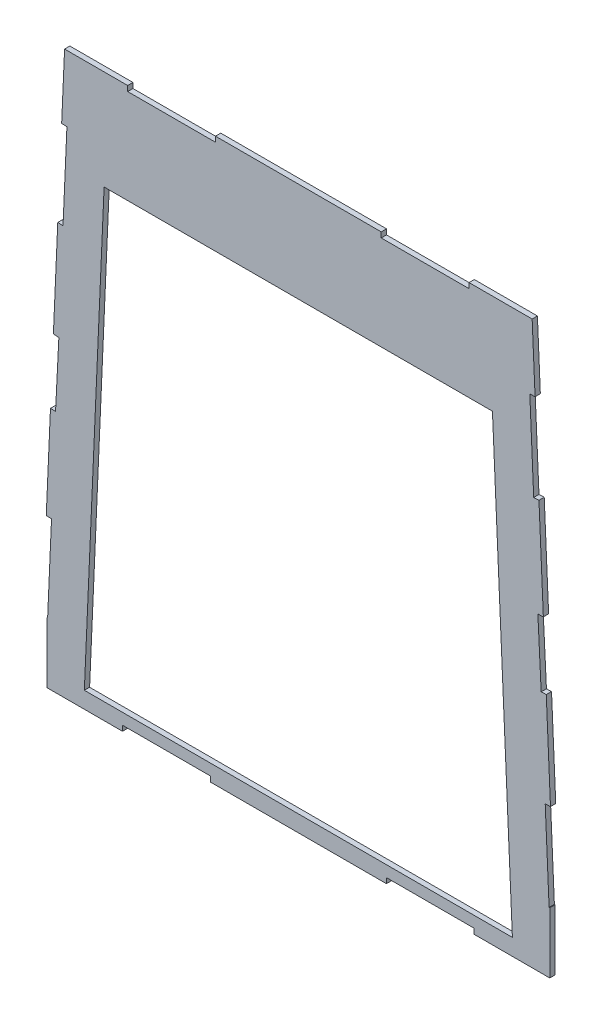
SolidWorks part; units mm, degrees
ref_plane "Front Plane" through (0, 0, 0) normal (0, 0, 1) x (1, 0, 0)
ref_plane "Top Plane" through (0, 0, 0) normal (0, 1, 0) x (1, 0, 0)
ref_plane "Right Plane" through (0, 0, 0) normal (1, 0, 0) x (0, 0, -1)
sketch "Sketch1" plane through (0, 0, 0) normal (0, 0, 1) x (1, 0, 0)
  line L0 (64.2461, -53.3168) -> (58.4748, 75.6208)
  line L1 (58.4748, 75.6208) -> (-53.8589, 75.6208)
  line L2 (-53.8589, 75.6208) -> (-59.5769, -53.3168)
  line L3 (70.4092, 59.9698) -> (69.2839, 85.3449)
  line L4 (69.9616, 104.463) -> (51.7102, 104.463)
  line L5 (-65.2924, 104.463) -> (-66.1372, 85.4124)
  line L6 (77.1698, -58.0793) -> (53.2038, -58.0793)
  line L7 (73.1993, 31.4539) -> (71.6181, 31.3847)
  line L8 (53.2038, -58.0793) -> (53.2038, -56.5553)
  line L9 (64.2461, -53.3168) -> (-59.5769, -53.3168)
  line L10 (27.8038, -58.0793) -> (27.8038, -56.5553)
  line L11 (-48.5345, -56.5553) -> (-23.1345, -56.5553)
  line L12 (53.2038, -56.5553) -> (27.8038, -56.5553)
  line L13 (27.8038, -58.0793) -> (-23.1345, -58.0793)
  line L14 (-23.1345, -58.0793) -> (-23.1345, -56.5553)
  line L15 (-48.5345, -58.0793) -> (-48.5345, -56.5553)
  line L16 (-48.5345, -58.0793) -> (-72.5005, -58.0793)
  line L17 (-71.7176, -40.4238) -> (-72.5005, -58.0793)
  line L18 (-71.7176, -40.4238) -> (-70.1951, -40.4913)
  line L19 (-70.5923, -15.0488) -> (-69.0698, -15.1163)
  line L20 (71.6181, 31.3847) -> (72.5716, 12.3595)
  line L21 (-70.1951, -40.4913) -> (-69.0698, -15.1163)
  line L22 (-67.2625, 60.0373) -> (-68.5301, 31.4539)
  line L23 (-67.2625, 60.0373) -> (-65.74, 59.9698)
  line L24 (-66.1372, 85.4124) -> (-64.6147, 85.3449)
  line L25 (70.8064, 85.4124) -> (69.2839, 85.3449)
  line L26 (-65.74, 59.9698) -> (-64.6147, 85.3449)
  line L27 (71.9317, 60.0373) -> (70.4092, 59.9698)
  line L28 (71.9317, 60.0373) -> (73.1993, 31.4539)
  line L29 (74.8643, -40.4913) -> (73.739, -15.1163)
  line L30 (75.2615, -15.0488) -> (73.739, -15.1163)
  line L31 (76.3868, -40.4238) -> (74.8643, -40.4913)
  line L32 (76.3868, -40.4238) -> (77.1698, -58.0793)
  line L33 (69.9616, 104.463) -> (70.8064, 85.4124)
  line L34 (26.3102, 104.463) -> (-21.6409, 104.463)
  line L35 (26.3102, 104.463) -> (26.3102, 102.939)
  line L36 (51.7102, 104.463) -> (51.7102, 102.939)
  line L37 (-21.6409, 102.939) -> (-47.0409, 102.939)
  line L38 (26.3102, 102.939) -> (51.7102, 102.939)
  line L39 (-47.0409, 104.463) -> (-47.0409, 102.939)
  line L40 (-21.6409, 104.463) -> (-21.6409, 102.939)
  line L41 (-47.0409, 104.463) -> (-65.2924, 104.463)
  line L42 (72.5716, 12.3595) -> (74.0433, 12.4227)
  line L43 (74.0433, 12.4227) -> (75.2615, -15.0488)
  line L44 (2.3346, 104.463) -> (2.3346, 150.1904) construction
  line L45 (-67.9023, 12.3595) -> (-69.374, 12.4227)
  line L46 (-66.9488, 31.3847) -> (-67.9023, 12.3595)
  line L47 (-68.5301, 31.4539) -> (-66.9488, 31.3847)
  line L48 (-69.374, 12.4227) -> (-70.5923, -15.0488)
  point P13 (77.172, -53.3168)
  point P15 (-72.5005, -53.3168)
extrude "Boss-Extrude1" add sketch "Sketch1" along normal blind 1.524
sketch "Sketch3" plane through (0, 0, 1.524) normal (0, 0, 1) x (1, 0, 0)
  line L0 (-70.3907, -40.4827) -> (-70.3907, -59.7549)
  line L1 (-70.1951, -40.4913) -> (-71.7176, -40.4238) construction
  line L2 (-70.3907, -59.7549) -> (-75.8471, -59.7549)
  line L3 (-75.8471, -59.7549) -> (-74.8521, -37.3173)
  line L4 (-74.8521, -37.3173) -> (-70.3907, -40.4827)
  line L5 (2.3346, -58.0793) -> (2.3346, -132.8339) construction
  line L6 (-23.1345, -58.0793) -> (27.8038, -58.0793) construction
  line L7 (79.5213, -37.3173) -> (75.06, -40.4827)
  line L8 (80.5163, -59.7549) -> (79.5213, -37.3173)
  line L9 (75.06, -59.7549) -> (80.5163, -59.7549)
  line L10 (75.06, -40.4827) -> (75.06, -59.7549)
extrude "Cut-Extrude4" cut sketch "Sketch3" against normal through all
